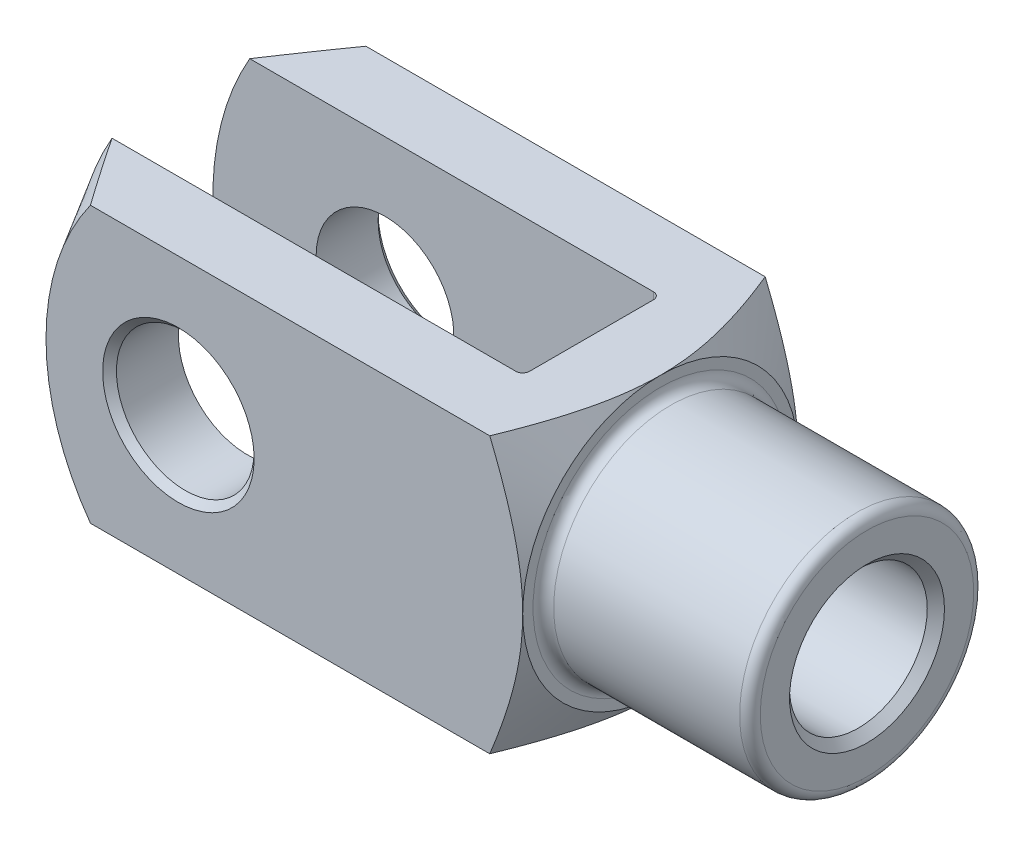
SolidWorks part; units mm, degrees
ref_plane "Front Plane" through (0, 0, 0) normal (0, 0, 1) x (1, 0, 0)
ref_plane "Top Plane" through (0, 0, 0) normal (0, 1, 0) x (1, 0, 0)
ref_plane "Right Plane" through (0, 0, 0) normal (1, 0, 0) x (0, 0, -1)
sketch "Sketch1" plane through (0, 0, 0) normal (1, 0, 0) x (0, 0, -1)
  line L0 (0, 0) -> (0, 50000) construction
  line L1 (0, 0) -> (50000, 0) construction
  line L2 (-20, -20) -> (-20, 20)
  line L3 (-20, 20) -> (20, 20)
  line L4 (20, -20) -> (20, 20)
  line L5 (-20, -20) -> (20, -20)
  point P9 (0, 20)
  point P11 (20, 0)
  point P12 (-20, 0)
  dimension "D1" = 40
  dimension "D2" = 40
extrude "Extrude1" add sketch "Sketch1" against normal blind 105
sketch "Sketch2" plane through (0, 0, 0) normal (1, 0, 0) x (0, 0, -1)
  circle A0 centre (0, 0) radius 17
  circle A1 centre (0, 0) radius 34
  dimension "D1" = 34
  dimension "D2" = 68
extrude "Extrude2" cut sketch "Sketch2" against normal blind 30
sketch "Sketch3" plane through (0, 0, 20) normal (0, 0, 1) x (1, 0, 0)
  circle A0 centre (-80, 0) radius 10
  dimension "D1" = 20
  dimension "D2" = 80
extrude "Extrude3" cut sketch "Sketch3" against normal through all
sketch "Sketch4" plane through (0, 20, 0) normal (0, 1, 0) x (1, 0, 0)
  line L0 (0, 0) -> (-50000, 0) construction
  line L1 (-105, -10) -> (-105, 10)
  line L2 (-105, 20) -> (-105, -20) construction
  line L3 (-105, 10) -> (-40, 10)
  line L4 (-40, 10) -> (-40, -10)
  line L5 (-80, 20) -> (-80, -20) construction
  line L6 (-105, -10) -> (-40, -10)
  point P7 (-80, 0)
  point P13 (-40, 0)
  point P14 (-105, 0)
  dimension "D1" = 40
  dimension "D2" = 20
extrude "Extrude4" cut sketch "Sketch4" against normal through all
fillet "Fillet1" radius 1 2 edges at (-40, 0, 10) (-40, 0, -10)
fillet "Fillet2" radius 1.5 2 edges at (0, 0, -17) (-30, 0, -17)
chamfer "Chamfer2" distance 1 angle 45 2 edges at (-70, 0, -20) (-70, 0, 20)
sketch "Sketch6" plane through (0, 0, 0) normal (0, 0, 1) x (1, 0, 0)
  line L0 (-30, -20) -> (-30, -40)
  line L1 (-30, -40) -> (-41.547, -40)
  line L2 (-41.547, -40) -> (-30, -20)
  dimension "D1" = 30
  dimension "D2" = 40
revolve "Cut-Revolve1" cut sketch "Sketch6" angle 360 about axis through (-30, 0, 0) along (1, 0, 0)
sketch "Sketch7" plane through (0, 0, 0) normal (0, 1, 0) x (1, 0, 0)
  line L0 (-99.2265, -20) -> (-105, -10)
  line L1 (-105, 10) -> (-99.2265, 20)
  line L2 (-99.2265, 20) -> (-145, 20)
  line L3 (-105, 10) -> (-105, -10)
  line L4 (-145, 20) -> (-145, -20)
  line L5 (-145, -20) -> (-99.2265, -20)
  line L6 (-105, 20) -> (-34.7829, 20) construction
  line L7 (-105, -20) -> (-34.7829, -20) construction
  line L8 (-65, 0.6162) -> (-65, 50000.6162) construction
  dimension "D1" = 120
  dimension "D2" = 40
  dimension "D3" = 40
revolve "Cut-Revolve2" cut sketch "Sketch7" angle 180 about L8
sketch "Sketch8" plane through (0, 0, 0) normal (1, 0, 0) x (0, 0, -1)
  circle A0 centre (0, 0) radius 10
  dimension "D1" = 20
extrude "Extrude5" cut sketch "Sketch8" against normal through all
chamfer "Chamfer3" distance 1.25 angle 45 1 edges at (0, 0, -10)
equation "\"D2@Sketch1\" = \"D1@Sketch1\""
equation "\"D2@Sketch2\" = \"D1@Sketch2\"*2"
equation "\"D2@Sketch6\" = \"D1@Sketch1\""
equation "\"D2@Sketch7\" = \"D1@Sketch1\""
equation "\"D3@Sketch7\" = \"D1@Sketch1\""
